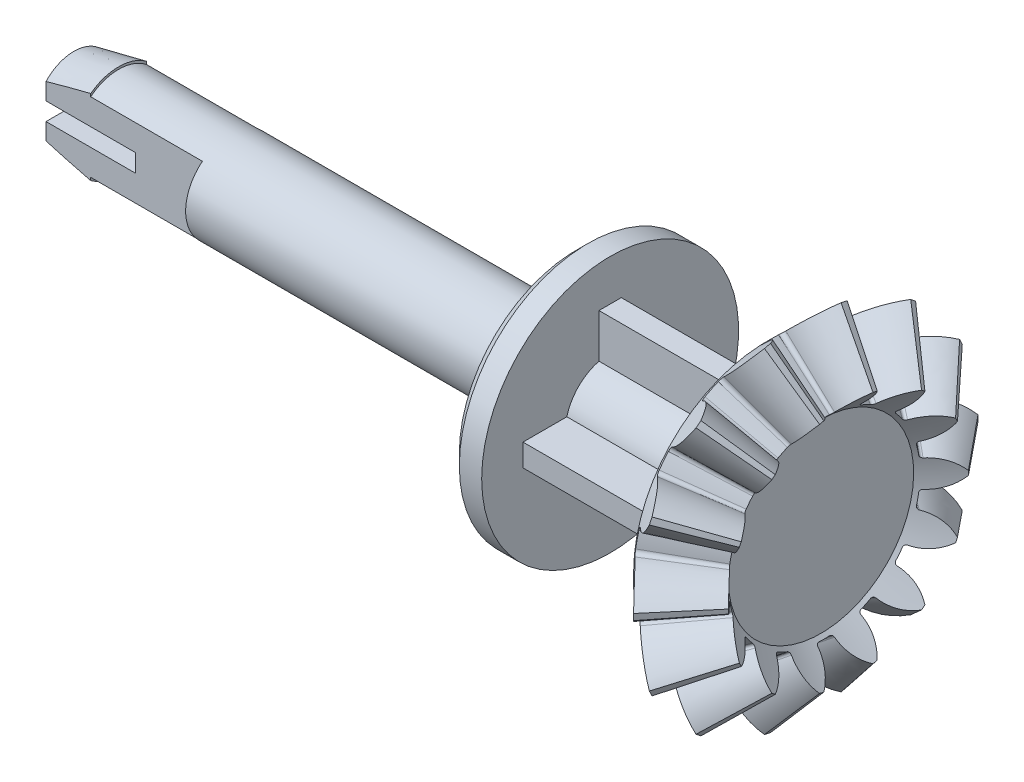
SolidWorks part; units mm, degrees
other "<straight bevel pinion_iso>-<Bore>"
ref_plane "前视基准面" through (0, 0, 0) normal (0, 0, 1) x (1, 0, 0)
ref_plane "上视基准面" through (0, 0, 0) normal (0, 1, 0) x (1, 0, 0)
ref_plane "右视基准面" through (0, 0, 0) normal (1, 0, 0) x (0, 0, -1)
ref_plane "Plane1-straight bevel pinion_iso" through (0, 0, 0) normal (0, 0, 1) x (1, 0, 0)
ref_plane "Plane2-straight bevel pinion_iso" through (0, 0, 0) normal (0, 1, 0) x (1, 0, 0)
ref_plane "Plane3-straight bevel pinion_iso" through (0, 0, 0) normal (1, 0, 0) x (0, 0, -1)
sketch "HoldingSke-straight bevel pinion_iso" plane through (0, 0, 0) normal (0, 1, 0) x (1, 0, 0)
  line L0 (0, 0) -> (0.9703, -0.2419)
  line L1 (-15, 0) -> (100, 0) construction
  line L2 (0, 0) -> (-117.8836, 28.0362)
  line L3 (0, 0) -> (-11.863, 4.5341)
  line L4 (0, 0) -> (8.3795, 2.0892)
  line L5 (0, 0) -> (-46.8476, -17.4728)
  line L6 (0, 0) -> (-10.5278, -7.1032)
  line L7 (-117.8836, 28.0362) -> (-115.7636, 77.9913)
  line L8 (-76.2, 1) -> (-76.1, 1)
  line L9 (-71.009, 38.7566) -> (-53.1078, 45.2721)
  line L10 (-76.2, 71.12) -> (104.1128, 71.12)
  line L11 (0, 0) -> (-3, 0)
  line L12 (-76.2, 101.6) -> (-76.162, 101.6)
  line L13 (24.9733, 27.94) -> (52.9518, 28.4284)
  line L14 (24.9733, 27.94) -> (24.9743, 27.94)
  line L15 (24.9733, 27.94) -> (100.4024, 29.5042)
  line L16 (-117.8836, 28.0362) -> (7.3887, -3.1977)
  circle A0 centre (0, 0) radius 0.5
  circle A1 centre (0, 0) radius 2
  circle A2 centre (0, 0) radius 2
  circle A3 centre (0, 0) radius 0.5
  dimension "MHD" = 4
  dimension "Hub_dia" = 4
  dimension "Bore" = 1
  dimension "MBD" = 1
  dimension "Num_teeth" = 14
  dimension "Pitch_radius" = 180.3128
  dimension "Pitch" = 1
  dimension "Width" = 3
  dimension "Mounting_dist" = 50
  dimension "Show_teeth" = 14
  dimension "Thickness" = 12.7
  dimension "OAL" = 50.0001
  dimension "T_dim" = 0.1
  dimension "Ap" = 20
  dimension "H" = 19.05
  dimension "Backlash" = 0.038
  dimension "Addendum_fac" = 1
  dimension "Dedendum_fac" = 1.188
  dimension "Clearance_fac" = 0.188
  dimension "Dedendum_add" = 0.001
  dimension "Mating_teeth" = 14
  dimension "MnMD" = 8.0509
  dimension "Module" = 1
sketch "BasProSke-straight bevel pinion_iso" plane through (0, 0, 0) normal (0, 1, 0) x (1, 0, 0)
  line L0 (-10, 0) -> (60, 0) construction
  line L1 (0, 0) -> (0, 5.9491)
  line L2 (0, 0) -> (2.4398, 0)
  line L3 (2.4398, 0) -> (2.4398, 4.1462)
  line L4 (8.0509, 0) -> (-21.3711, 29.422) construction
  line L5 (0, 5.9491) -> (1.758, 7.7071)
  line L6 (8.0509, 0) -> (-52.9979, 74.7685) construction
  line L7 (8.0509, 0) -> (0, 5.9491) construction
  line L8 (1.758, 7.7071) -> (3.6651, 5.3715)
  line L9 (3.6651, 5.3715) -> (2.4398, 4.1462)
  line L10 (1.0509, 7) -> (-10.9334, 7) construction
  dimension "D2" = 8.0509
  dimension "D3" = 9.8995
  dimension "D1" = 11.8981
  dimension "D4" = 5.768
  dimension "Addendum" = 1
  dimension "Pitch_rad" = 7
  dimension "Dedendum_plus" = 1.4863
  dimension "Face_wid" = 3
  dimension "Pitch_ang" = 45
ref_plane "ToothPln-straight bevel pinion_iso" through (0.879, 6.8281, 0) normal (-0.7071, 0.7071, 0) x (0, 0, -1)
ref_plane "ToothPln2-straight bevel pinion_iso" through (4.0255, -4.0255, 0) normal (-0.7071, 0.7071, 0) x (0, 0, 1)
sketch "TooCutSke-straight bevel pinion_iso" plane through (0.879, 6.8281, 0) normal (-0.7071, 0.7071, 0) x (0, 0, -1)
  line L2 (0, 6.7569) -> (371.2262, -1619.6916) construction
  line L3 (0, 6.7569) -> (202.8345, -1750.3061) construction
  line L4 (0, -15.621) -> (0, 105.791) construction
  line L6 (-24.765, -1.2431) -> (21.082, -1.2431) construction
  line L7 (1.5576, -0.0676) -> (0.7979, -0.1553) construction
  arc A0 (-1.7111, -1.2217) -> (1.7111, -1.2217) centre (0, 6.7569) ccw
  arc A1 (-0.3296, 0.9552) -> (0.3296, 0.9552) centre (0, 6.7569) ccw
  circle A2 centre (0, 6.7569) radius 7 construction
  circle A3 centre (0, 6.7569) radius 6.5778 construction
  arc A4 (0.5283, 0.786) -> (0.3296, 0.9552) centre (0.3403, 0.7665) ccw
  arc A5 (0.5283, 0.786) -> (1.7111, -1.2217) centre (3.3134, 1.0745) ccw
  arc A6 (-1.7111, -1.2217) -> (-0.5283, 0.786) centre (-3.3134, 1.0745) ccw
  arc A7 (-0.3296, 0.9552) -> (-0.5283, 0.786) centre (-0.3403, 0.7665) ccw
  dimension "Overcut_dia" = 16.32
  dimension "Root_dia" = 11.622
  dimension "Pitch_dia" = 14
  dimension "Base_dia" = 13.1557
  dimension "Flank_rad" = 2.8
  dimension "Root_fillet" = 0.189
  dimension "Radius" = 8
  dimension "Half_ang" = 12.857
  dimension "Half_CT" = 0.7648
sketch "TooCutSke2-straight bevel pinion_iso" plane through (4.0255, -4.0255, 0) normal (-0.7071, 0.7071, 0) x (0, 0, 1)
  line L0 (0, 0) -> (0, 68.072) construction
  line L2 (21.082, 4.2066) -> (-20.32, 4.2066) construction
  circle A0 centre (0, 5.6929) radius 0.0127
  dimension "Diameter" = 0.0254
  dimension "Dedendum_plus" = 1.4863
sketch "HubSke-straight bevel pinion_iso" plane through (0, 0, 0) normal (-1, 0, 0) x (0, 0, 1)
  circle A0 centre (0, 0) radius 2
  dimension "Diameter" = 4
sketch "BorSke-straight bevel pinion_iso" plane through (0, 0, 0) normal (1, 0, 0) x (0, 0, -1)
  circle A0 centre (0, 0) radius 0.5
  dimension "Diameter" = 1
sketch "KeySke-straight bevel pinion_iso" [suppressed] plane through (0, 0, 0) normal (1, 0, 0) x (0, 0, -1)
  line L0 (-3.175, 0) -> (-3.175, 0.6)
  line L1 (-3.175, 0.6) -> (-3.075, 0.6)
  line L2 (-3.075, 0.6) -> (-3.075, 0)
  line L3 (-3.125, 0) -> (-3.125, 34) construction
  line L4 (-3.175, 0) -> (-3.075, 0)
  dimension "Offset" = 0.6
  dimension "Width" = 0.1
inserted part "straight bevel pinion_iso" parameters "Num_teeth.HoldingSke"=14, "Pitch.HoldingSke"=1, "MHD.HoldingSke"=4, "Hub_dia.HoldingSke"=4, "Mounting_dist.HoldingSke"=50, "Show_teeth.HoldingSke"=14, "Thickness.HoldingSke"=12.7, "OAL.HoldingSke"=50.0001, "T_dim.HoldingSke"=0.1, "Ap.HoldingSke"=20, "H.HoldingSke"=19.05, "Pitch_radius.HoldingSke"=180.3128, "Width.HoldingSke"=3, "Bore.HoldingSke"=1, "Backlash.HoldingSke"=0.038, "Addendum_fac.HoldingSke"=1, "Dedendum_fac.HoldingSke"=1.188, "Clearance_fac.HoldingSke"=0.188, "Dedendum_add.HoldingSke"=0.001, "Mating_teeth.HoldingSke"=14, "MnMD.HoldingSke"=8.0509, "MBD.HoldingSke"=1, "Module.HoldingSke"=1, "D1.Base-Revolve"=360, "Addendum.BasProSke"=1, "Pitch_rad.BasProSke"=7, "Dedendum_plus.BasProSke"=1.4863, "Face_wid.BasProSke"=3, "Pitch_ang.BasProSke"=45, "D1.BasProSke"=11.8981, "D2.BasProSke"=8.0509, "D3.BasProSke"=9.8995, "D4.BasProSke"=5.768, "Offset.ToothPln2"=9.8995, "Dedendum_plus.TooCutSke2"=1.4863, "Diameter.TooCutSke2"=0.0254, "Radius.TooCutSke"=8, "Overcut_dia.TooCutSke"=16.32, "Root_dia.TooCutSke"=11.622, "Pitch_dia.TooCutSke"=14, "Base_dia.TooCutSke"=13.1557, "Half_ang.TooCutSke"=12.857, "Half_CT.TooCutSke"=0.7648, "Flank_rad.TooCutSke"=2.8, "Root_fillet.TooCutSke"=0.189, "Angle.TeethCuts"=25.714, "Num_teeth.TeethCuts"=14, "Length.Hub"=41.9492, "Diameter.HubSke"=4, "D1.Bore"=100.0001, "Diameter.BorSke"=1
move or copy body "实体-移动/复制2" placed by mates yes
sketch "草图9" plane through (-41.9492, 0, 0) normal (-1, 0, 0) x (0, 0, 1)
  circle A0 centre (0, 0) radius 2
extrude "切除-拉伸1" cut sketch "草图9" against normal blind 15
sketch "草图10" plane through (0, 0, 0) normal (-1, 0, 0) x (0, 0, 1)
  circle A0 centre (0, 0) radius 2
  dimension "D1" = 4
extrude "凸台-拉伸1" add sketch "草图10" along normal blind 29
sketch "草图11" plane through (0, 0, 0) normal (-1, 0, 0) x (0, 0, 1)
  line L0 (0, 0) -> (0, 3.9) construction
  line L1 (0.5, 1.9365) -> (0.5, 3.9)
  line L2 (-0.5, 1.9365) -> (-0.5, 3.9)
  line L3 (-0.5, 3.9) -> (0.5, 3.9)
  line L5 (-0.5, 0) -> (-0.5, 3.9) construction
  line L6 (0.5, 0) -> (0.5, 3.9) construction
  arc A0 (0.5, 1.9365) -> (-0.5, 1.9365) centre (0, 0) ccw
  dimension "D4" = 4
  dimension "D1" = 3.9
  dimension "D2" = 0.5
  dimension "D3" = 0.5
extrude "凸台-拉伸2" add sketch "草图11" along normal blind 7
pattern_circular "阵列(圆周)1" count 4 over 360 about axis through (0, 0, 0) along (1, 0, 0) of "凸台-拉伸2"
sketch "草图12" plane through (-7, 0, 0) normal (-1, 0, 0) x (0, 0, 1)
  circle A0 centre (0, 0) radius 5.75
  dimension "D1" = 11.5
extrude "凸台-拉伸3" add sketch "草图12" along normal blind 1.5
chamfer "倒角1" distance 0.5 angle 45 1 edges at (-8.5, 0, 5.75)
sketch "草图14" plane through (0, 0, 0) normal (0, 0, 1) x (1, 0, 0)
  line L0 (-29, 0) -> (-31, 0)
  line L1 (-29, 2) -> (-29, -2) construction
  line L2 (-31, 0) -> (-31, 1.7)
  line L3 (-31, 1.7) -> (-29, 2.1)
  line L4 (-29, 2.1) -> (-29, 0)
  dimension "D1" = 2
  dimension "D2" = 1.7
  dimension "D3" = 2.1
revolve "旋转1" add sketch "草图14" angle 360 about L0
sketch "草图15" plane through (-31, 0, 0) normal (-1, 0, 0) x (0, 0, 1)
  line L0 (0, 5.25) -> (0, -5.25) construction
  line L1 (-1.25, 5.25) -> (-1.25, -5.25)
  line L2 (1.25, 5.25) -> (1.25, -5.25)
  line L3 (-3, 5.25) -> (-3, -5.25)
  line L4 (3, 5.25) -> (3, -5.25)
  line L5 (-3, 5.25) -> (-1.25, 5.25)
  line L6 (1.25, 5.25) -> (3, 5.25)
  line L7 (-3, -5.25) -> (-1.25, -5.25)
  line L8 (1.25, -5.25) -> (3, -5.25)
  circle A0 centre (0, 0) radius 5.25 construction
  dimension "D1" = 1.25
  dimension "D2" = 1.25
  dimension "D3" = 3
  dimension "D4" = 3
extrude "切除-拉伸2" cut sketch "草图15" against normal blind 7
sketch "草图16" plane through (-31, 0, 0) normal (-1, 0, 0) x (0, 0, 1)
  line L0 (-1.25, 0.4) -> (1.25, 0.4)
  line L1 (-1.25, 0.4) -> (-1.25, -0.4)
  line L2 (1.25, 0.4) -> (1.25, -0.4)
  line L3 (-1.25, -0.4) -> (1.25, -0.4)
  line L4 (-1.25, 0.4) -> (1.25, -0.4) construction
  line L5 (1.25, 0.4) -> (-1.25, -0.4) construction
  point P1 (0, 0)
  dimension "D1" = 2.5
  dimension "D2" = 0.8
extrude "切除-拉伸3" cut sketch "草图16" against normal blind 4
sketch "草图17" plane through (0, 0, 0) normal (1, 0, 0) x (0, 0, -1)
  circle A0 centre (0, 0) radius 0.5
  dimension "D1" = 1
extrude "凸台-拉伸4" add sketch "草图17" along normal up to surface (2.4398 mm away)
